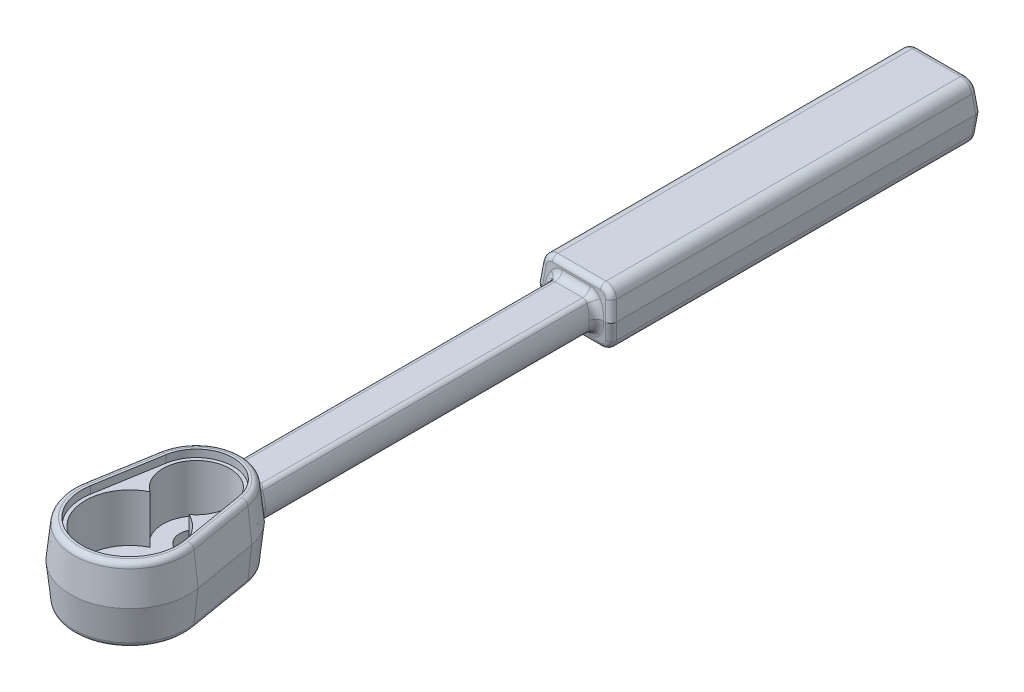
SolidWorks part; units mm, degrees
ref_plane "Front" through (0, 0, 0) normal (0, 0, 1) x (1, 0, 0)
ref_plane "Top" through (0, 0, 0) normal (0, 1, 0) x (1, 0, 0)
ref_plane "Right" through (0, 0, 0) normal (1, 0, 0) x (0, 0, -1)
sketch "Sketch2" plane through (0, 0, 0) normal (0, 1, 0) x (1, 0, 0)
  line L0 (0, 0) -> (0, 120) construction
  line L1 (-10, 220) -> (10, 220)
  line L2 (-10, 220) -> (-10, 120)
  line L3 (-10, 120) -> (10, 120)
  line L4 (10, 220) -> (10, 120)
  dimension "D1" = 220
  dimension "D2" = 20
  dimension "D3" = 100
extrude "Handle" add sketch "Sketch2" along normal mid plane 15 draft 6
sketch "Sketch3" plane through (0, 0, 0) normal (0, 0, 1) x (1, 0, 0)
  line L0 (-4.4721, 4) -> (4.4721, 4)
  line L1 (-4.4721, -4) -> (4.4721, -4)
  arc A0 (4.4721, -4) -> (4.4721, 4) centre (0, 0) ccw
  arc A1 (-4.4721, 4) -> (-4.4721, -4) centre (0, 0) ccw
  dimension "D1" = 12
  dimension "D2" = 8
  dimension "D3" = 4
extrude "Transition" add sketch "Sketch3" against normal up to next
sketch "Sketch4" plane through (0, 0, 0) normal (0, 1, 0) x (1, 0, 0)
  line L0 (-15.7762, 2.6667) -> (-12.8182, 20.1667)
  line L1 (12.8182, 20.1667) -> (15.7762, 2.6667)
  line L2 (0, 0) -> (0, 39.2442) construction
  line L3 (0, 244.1401) -> (0, 171.7228) construction
  arc A0 (-12.8182, 20.1667) -> (12.8182, 20.1667) centre (0, 18) cw
  arc A1 (15.7762, 2.6667) -> (-15.7762, 2.6667) centre (0, 0) cw
  dimension "D1" = 13
  dimension "D2" = 16
  dimension "D3" = 18
extrude "Head" add sketch "Sketch4" along normal mid plane 20
sketch "Sketch5" plane through (0, 10, 0) normal (0, 1, 0) x (-1, 0, 0)
  line L6 (-12.7678, -2.1582) -> (-9.8098, -19.6582)
  line L7 (9.8098, -19.6582) -> (12.7678, -2.1582)
  line L8 (-12.7678, -2.1582) -> (-9.8098, -19.6582)
  line L9 (9.8098, -19.6582) -> (12.7678, -2.1582)
  arc A6 (12.7678, -2.1582) -> (-12.7678, -2.1582) centre (0, 0) ccw
  arc A7 (-9.8098, -19.6582) -> (9.8098, -19.6582) centre (0, -18) ccw
  arc A8 (12.7678, -2.1582) -> (-12.7678, -2.1582) centre (0, 0) ccw
  arc A9 (-9.8098, -19.6582) -> (9.8098, -19.6582) centre (0, -18) ccw
  dimension "D1" = 2
extrude "Recess" cut sketch "Sketch5" against normal blind 2
sketch "Sketch6" plane through (0, 8, 0) normal (0, 1, 0) x (-1, 0, 0)
  arc A0 (-5.3327, -10.75) -> (5.3327, -10.75) centre (0, -18) ccw
  arc A1 (5.3327, -10.75) -> (-5.3327, -10.75) centre (0, 0) ccw
  arc A3 (12.7678, -2.1582) -> (-12.7678, -2.1582) centre (0, 0) ccw construction
  dimension "D1" = 18
  dimension "D2" = 24
extrude "Pocket" cut sketch "Sketch6" against normal blind 13
sketch "Sketch7" plane through (0, -5, 0) normal (0, 1, 0) x (-1, 0, 0)
  circle A0 centre (0, -18) radius 4.5
  dimension "D1" = 9
extrude "WheelHole" cut sketch "Sketch7" against normal through all
extrude "RatchetHole" cut sketch "Sketch8" against normal through all
sketch "Sketch8" plane through (-4.6401, -5, 13.5993) normal (0, 1, 0) x (-1, 0, 0)
  circle A0 centre (-4.6401, -13.5993) radius 4.5
  arc A1 (10.0998, -16.0908) -> (-19.38, -16.0908) centre (-4.6401, -13.5993) ccw construction
  dimension "D1" = 9
fillet "HandleFillets" radius 3 4 edges at (9.2117, 7.5, -170) (-9.2117, -7.5, -170) (9.2117, -7.5, -170) (-9.2117, 7.5, -170)
fillet "H End Fillets" radius 1.5 36 edges at (0, 7.5, -120.7883) (0, 7.5, -219.2117) (9.747, 2.4068, -120.253) (-9.747, 2.4068, -120.253) (8.5179, 6.7294, -120.7073) (-8.5179, 6.7294, -120.7073) (-9.747, 2.4068, -219.747) (9.747, 2.4068, -219.747) (8.5179, 6.7294, -219.2927) (-8.5179, 6.7294, -219.2927) (4.4721, -4, -75.0891) (4.4721, 4, -75.0891) (-4.4721, 4, -75.0891) (-5.605, 2.1409, -120.225) (-4.4721, -4, -75.0891) (-5.605, -2.1409, -120.225) (5.5016, 2.3941, -29.5001) (0, 10, 14.949) (13.2609, 10, -11.2415) (0, 10, -29.949) (-13.2609, 10, -11.2415) (0, -10, 14.949) (-13.2609, -10, -11.2415) (5.5016, -2.3941, -29.5001) (0, -10, -29.949) (13.2609, -10, -11.2415) (-9.747, -2.4068, -219.747) (-9.747, -2.4068, -120.253) (0, -7.5, -120.7883) (9.747, -2.4068, -120.253) (8.5179, -6.7294, -120.7073) (-8.5179, -6.7294, -120.7073) (0, -7.5, -219.2117) (9.747, -2.4068, -219.747) (8.5179, -6.7294, -219.2927) (-8.5179, -6.7294, -219.2927)
fillet "TransFillet" radius 2 20 edges at (0, -4, -120.4204) (-5.7417, -1.7417, -120.1831) (-5.7417, 1.7417, -120.1831) (0, 4, -120.4204) (0, -4, -30.5796) (5.5016, -2.3941, -29.5001) (5.5016, 2.3941, -29.5001) (0, 4, -30.5796) (4.2572, -3.9086, -29.8475) (4.4488, -3.8229, -120.4018) (4.6454, 3.6972, -29.7247) (4.4488, 3.8229, -120.4018) (-4.2572, 3.9086, -29.8475) (-4.4488, 3.8229, -120.4018) (-4.6454, -3.6972, -29.7247) (-4.4488, -3.8229, -120.4018) (5.7417, 1.7417, -120.1831) (5.7417, -1.7417, -120.1831) (-5.7195, -1.813, -29.4616) (-5.7195, 1.813, -29.4616)
